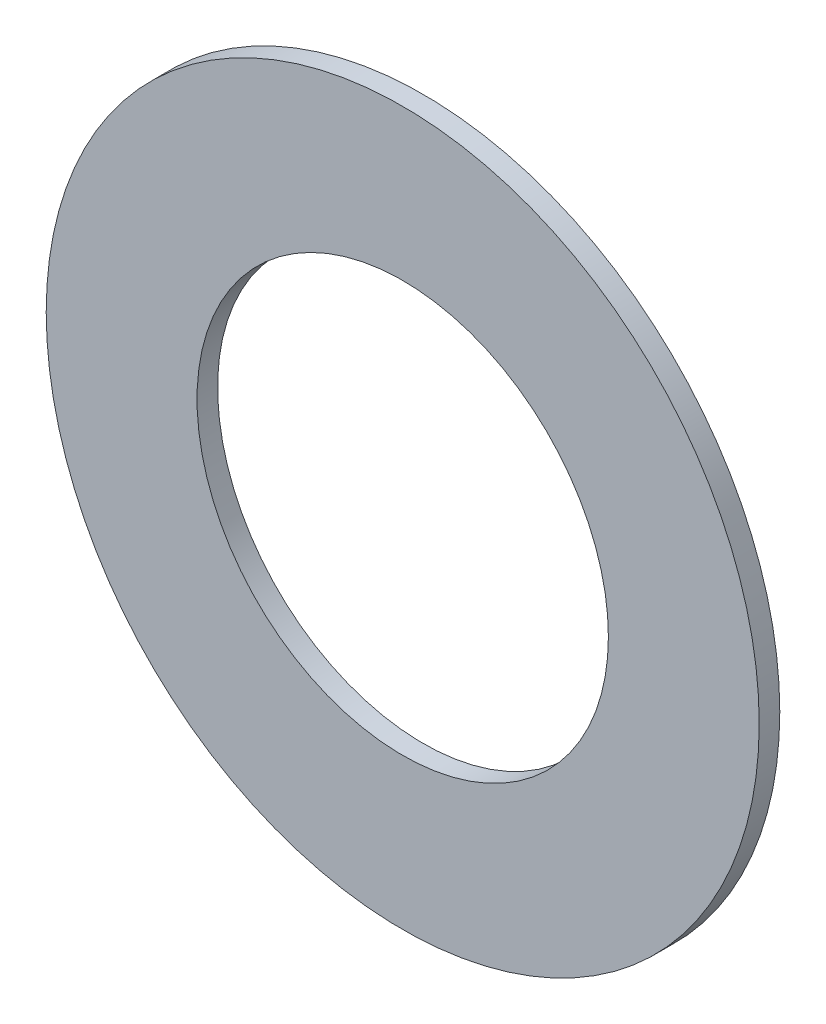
SolidWorks part; units mm, degrees
ref_plane "前视基准面" through (0, 0, 0) normal (0, 0, 1) x (1, 0, 0)
ref_plane "上视基准面" through (0, 0, 0) normal (0, 1, 0) x (1, 0, 0)
ref_plane "右视基准面" through (0, 0, 0) normal (1, 0, 0) x (0, 0, -1)
sketch "草图1" plane through (0, 0, 0) normal (0, 0, 1) x (1, 0, 0)
  circle A0 centre (0, 0) radius 26
extrude "凸台-拉伸1" add sketch "草图1" along normal blind 1.5
sketch "草图2" plane through (0, 0, 1.5) normal (0, 0, 1) x (1, 0, 0)
  circle A0 centre (0, 0) radius 15
extrude "切除-拉伸1" cut sketch "草图2" against normal blind 10
